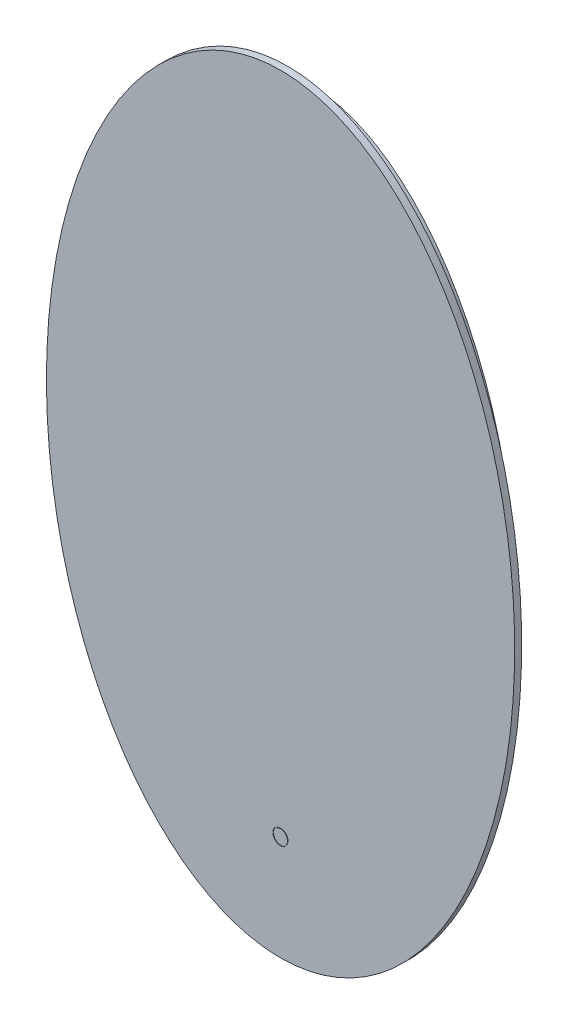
SolidWorks part; units mm, degrees
ref_plane "Alzado" through (0, 0, 0) normal (0, 0, 1) x (1, 0, 0)
ref_plane "Planta" through (0, 0, 0) normal (0, 1, 0) x (1, 0, 0)
ref_plane "Vista lateral" through (0, 0, 0) normal (1, 0, 0) x (0, 0, -1)
sketch "Croquis1" plane through (0, 0, 0) normal (0, 0, 1) x (1, 0, 0)
  ellipse E0 centre (0, 0) end of major axis (0, -550) minor radius 335
  point P0 (0, 0)
  point P4 (0, 0)
  point P8 (0, 0)
  dimension "D1" = 335
  dimension "D2" = 550
extrude "Saliente-Extruir1" add sketch "Croquis1" along normal blind 10
sketch "Croquis2" plane through (0, 0, 0) normal (0, 0, 1) x (1, 0, 0)
  spline S0 degree 3 number of poles 242 (0, 510) -> (0, 510)
  spline S1 degree 3 number of poles 242 (0, 510) -> (0, 510)
  dimension "D1" = 40
extrude "Saliente-Extruir2" add sketch "Croquis2" against normal blind 33
sketch "Croquis3" plane through (0, 0, -33) normal (0, 0, -1) x (-1, 0, 0)
  spline S2 degree 3 number of poles 250 (-0.8694, -508.9977) -> (-0.8694, -508.9977)
  spline S3 degree 3 number of poles 250 (-0.8694, -508.9977) -> (-0.8694, -508.9977)
  dimension "D1" = 1
extrude "Cortar-Extruir1" cut sketch "Croquis3" against normal blind 30
sketch "Croquis4" plane through (0, 0, 10) normal (0, 0, 1) x (1, 0, 0)
  line L0 (0, 0) -> (0, -400) construction
  circle A0 centre (0, -400) radius 11
  circle A1 centre (0, -400) radius 10
extrude "Cortar-Extruir2" cut sketch "Croquis4" against normal blind 0.5
